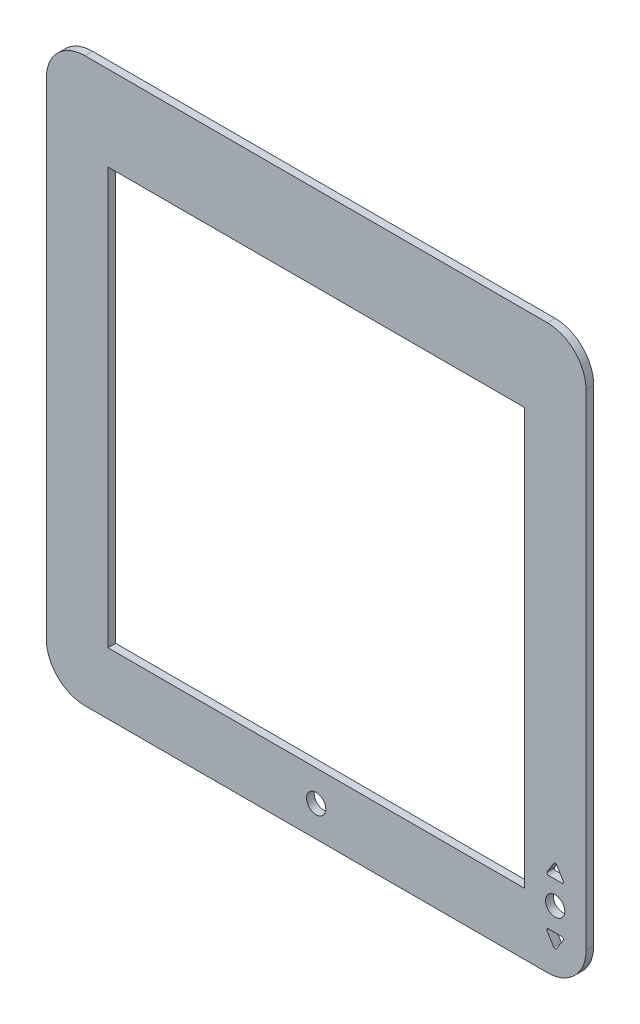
SolidWorks part; units mm, degrees
ref_plane "Front Plane" through (0, 0, 0) normal (0, 0, 1) x (1, 0, 0)
ref_plane "Top Plane" through (0, 0, 0) normal (0, 1, 0) x (1, 0, 0)
ref_plane "Right Plane" through (0, 0, 0) normal (1, 0, 0) x (0, 0, -1)
sketch "Sketch1" plane through (0, 0, 0) normal (0, 0, 1) x (1, 0, 0)
  line L1 (270, -270) -> (-270, -270)
  line L2 (270, -270) -> (270, 270)
  line L3 (270, 270) -> (-270, 270)
  line L4 (-270, -270) -> (-270, 270)
  line L5 (270, -270) -> (-270, 270) construction
  line L6 (270, 270) -> (-270, -270) construction
  line L7 (-350, -350) -> (-350, 350)
  line L8 (350, -350) -> (-350, -350)
  line L9 (350, -350) -> (350, 350)
  line L10 (350, 350) -> (-350, 350) construction
  line L11 (350, 380) -> (-350, 380)
  line L15 (-380, -380) -> (-380, 380) construction
  line L16 (380, -380) -> (380, 380) construction
  line L17 (380, -380) -> (-380, -380) construction
  line L18 (-350, 350) -> (-350, 380)
  line L19 (350, 350) -> (350, 380)
  line L20 (380, 380) -> (-380, 380) construction
  point P0 (0, 0)
  dimension "D1" = 540
  dimension "D2" = 80
  dimension "D3" = 110
extrude "Boss-Extrude1" add sketch "Sketch1" along normal blind 10
fillet "Fillet1" radius 50 4 edges at (350, -350, 5) (-350, -350, 5) (-350, 380, 5) (350, 380, 5)
sketch "Sketch2" plane through (0, 0, 10) normal (0, 0, 1) x (1, 0, 0)
  line L0 (0, -5.5) -> (0, 5.5) construction
  line L1 (0, -270) -> (0, -350) construction
  line L2 (-270, -270) -> (270, -270) construction
  line L3 (-300, -350) -> (300, -350) construction
  circle A0 centre (0, -310) radius 12.5
  arc A1 (-350, -300) -> (-300, -350) centre (-300, -300) ccw construction
  point P14 (0, -310)
  dimension "D1" = 25
extrude "Cut-Extrude1" cut sketch "Sketch2" against normal up to next
sketch "Sketch3" plane through (0, 0, 10) normal (0, 0, 1) x (1, 0, 0)
  line L0 (270, -229.8672) -> (350, -229.8672) construction
  line L1 (270, -270) -> (270, 270) construction
  line L2 (350, -300) -> (350, 330) construction
  line L3 (297.5, -240) -> (322.5, -240)
  line L4 (297.5, -240) -> (309.9974, -220)
  line L5 (309.9974, -220) -> (322.5, -240)
  line L6 (297.5, -300) -> (322.5, -300)
  line L7 (297.5, -300) -> (310, -320.0016)
  line L8 (310, -320.0016) -> (322.5, -300)
  circle A0 centre (310, -270) radius 12.5
  circle A1 centre (0, -310) radius 12.5 construction
  point P10 (310, -229.8672)
  point P14 (310, -240)
  dimension "D1" = 25
  dimension "D2" = 30
  dimension "D3" = 20
  dimension "D4" = 58
  dimension "D5" = 30
extrude "Cut-Extrude2" cut sketch "Sketch3" against normal up to next
fillet "Fillet2" radius 2 6 edges at (310, -320.0016, 5) (322.5, -300, 5) (297.5, -300, 5) (322.5, -240, 5) (297.5, -240, 5) (309.9974, -220, 5)
